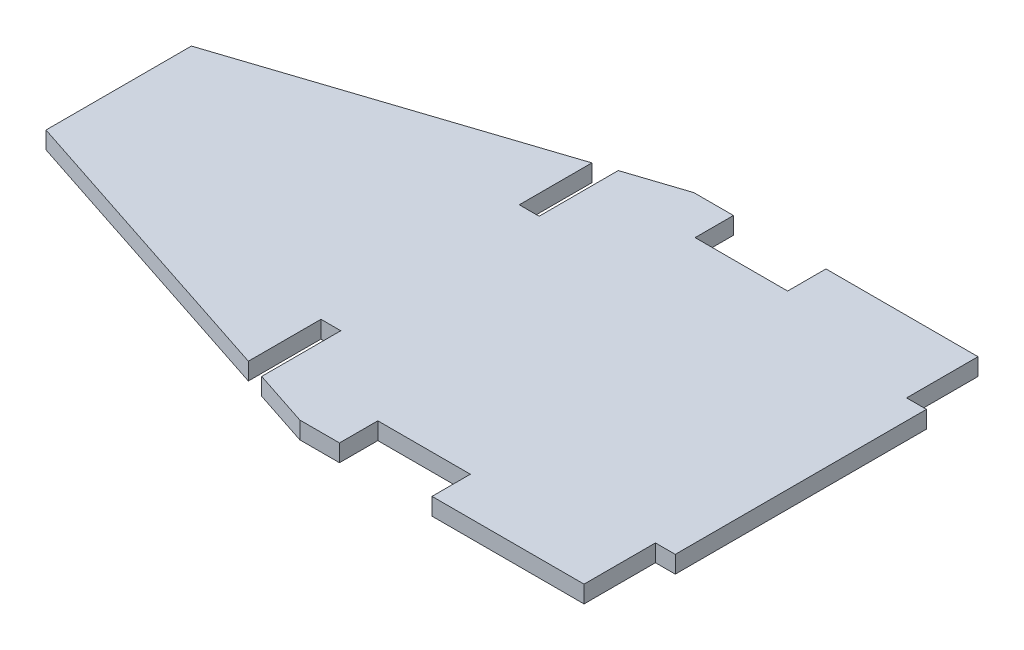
SolidWorks part; units mm, degrees
ref_plane "Plan de face" through (0, 0, 0) normal (0, 0, 1) x (1, 0, 0)
ref_plane "Plan de dessus" through (0, 0, 0) normal (0, 1, 0) x (1, 0, 0)
ref_plane "Plan de droite" through (0, 0, 0) normal (1, 0, 0) x (0, 0, -1)
sketch "Esquisse1" plane through (0, 0, 0) normal (0, 1, 0) x (1, 0, 0)
  line L0 (0, 0) -> (95.3819, 0) construction
  line L1 (51.6, 9.5) -> (51.6, -9.5)
  line L2 (0, -5.5) -> (0, 5.5)
  line L3 (0, 5.5) -> (22.8, 12.9937)
  line L4 (28.6, 14.9) -> (31.6, 14.9)
  line L5 (50.1, 14.9) -> (50.1, 9.5)
  line L6 (50.1, 9.5) -> (51.6, 9.5)
  line L7 (24.3, 13.4867) -> (28.6, 14.9)
  line L8 (38.6, 14.9) -> (50.1, 14.9)
  line L9 (22.8, 12.9937) -> (22.8, 7.5)
  line L10 (22.8, 7.5) -> (24.3, 7.5)
  line L11 (24.3, 13.4867) -> (24.3, 7.5)
  line L12 (38.6, -14.9) -> (38.6, -12)
  line L13 (31.6, 14.9) -> (31.6, 12)
  line L14 (31.6, 12) -> (38.6, 12)
  line L15 (38.6, 14.9) -> (38.6, 12)
  line L16 (31.6, -12) -> (38.6, -12)
  line L17 (31.6, -14.9) -> (31.6, -12)
  line L18 (24.3, -13.4867) -> (24.3, -7.5)
  line L19 (22.8, -7.5) -> (24.3, -7.5)
  line L20 (22.8, -12.9937) -> (22.8, -7.5)
  line L21 (38.6, -14.9) -> (50.1, -14.9)
  line L22 (24.3, -13.4867) -> (28.6, -14.9)
  line L23 (50.1, -9.5) -> (51.6, -9.5)
  line L24 (50.1, -14.9) -> (50.1, -9.5)
  line L25 (28.6, -14.9) -> (31.6, -14.9)
  line L26 (0, -5.5) -> (22.8, -12.9937)
  point P30 (51.6, 0)
  dimension "D1" = 51.6
  dimension "D2" = 29.8
  dimension "D3" = 11
  dimension "D4" = 23
  dimension "D5" = 1.5
  dimension "D6" = 5.4
  dimension "D7" = 1.5
  dimension "D8" = 15
  dimension "D9" = 22.8
  dimension "D10" = 7
  dimension "D11" = 13
  dimension "D12" = 24
extrude "Boss.-Extru.1" add sketch "Esquisse1" along normal blind 1.3
